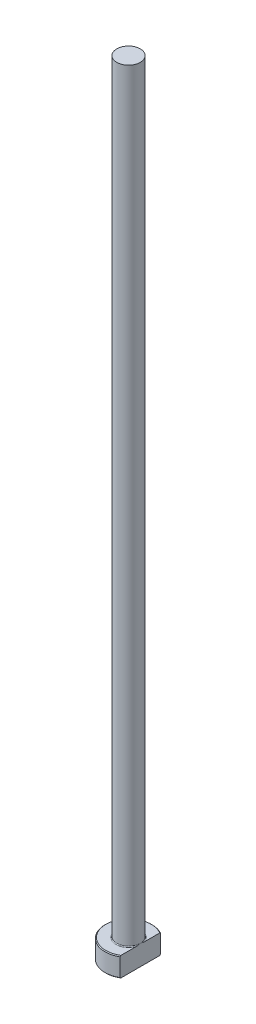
SolidWorks part; units mm, degrees
ref_plane "Front Plane" through (0, 0, 0) normal (0, 0, 1) x (1, 0, 0)
ref_plane "Top Plane" through (0, 0, 0) normal (0, 1, 0) x (1, 0, 0)
ref_plane "Right Plane" through (0, 0, 0) normal (1, 0, 0) x (0, 0, -1)
sketch "Sketch1" plane through (0, 0, 0) normal (0, 0, 1) x (1, 0, 0)
  line L0 (0, 259.9588) -> (0, -15.1925) construction
  line L1 (0, 0) -> (-6, 0)
  line L2 (-6, 0) -> (-6, 5)
  line L3 (-6, 5) -> (-3, 5)
  line L4 (-3, 5) -> (-3, 200)
  line L5 (-3, 200) -> (0, 200)
  line L6 (0, 200) -> (0, 0)
  dimension "L" = 200
  dimension "H" = 12
  dimension "T" = 5
  dimension "D" = 6
revolve "Revolve1" add sketch "Sketch1" angle 360 about L0
chamfer "Chamfer1" distance 0.2 angle 45 2 edges at (0, 5, 6) (0, 0, 6)
fillet "Fillet1" radius 0.2 1 edges at (0, 5, 3)
sketch "Sketch2" plane through (0, 0, 0) normal (0, 1, 0) x (1, 0, 0)
  line L0 (3, 5.1962) -> (3, -5.1962)
  circle A0 centre (0, 0) radius 6 construction
  arc A1 (3, -5.1962) -> (3, 5.1962) centre (0, 0) ccw
  circle A2 centre (0, 0) radius 3 construction
extrude "KEY" cut sketch "Sketch2" along normal through all
